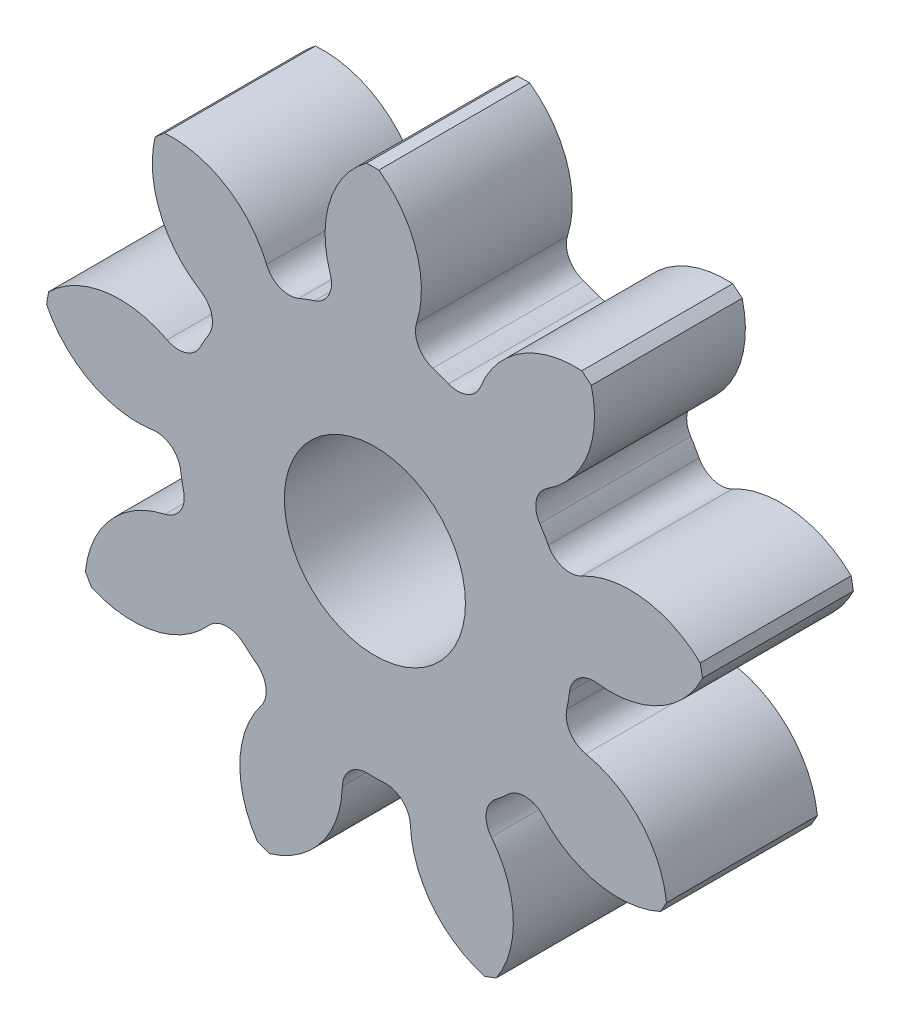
SolidWorks part; units mm, degrees
ref_plane "Front" through (0, 0, 0) normal (0, 0, 1) x (1, 0, 0)
ref_plane "Top" through (0, 0, 0) normal (0, 1, 0) x (1, 0, 0)
ref_plane "Right" through (0, 0, 0) normal (1, 0, 0) x (0, 0, -1)
sketch "Sketch3" plane through (0, 0, 0) normal (0, 0, 1) x (1, 0, 0)
  circle A0 centre (0, 0) radius 279.4
  dimension "od" = 558.8
extrude "gearBody" add sketch "Sketch3" along normal blind 127
sketch "Sketch2" plane through (0, 0, 0) normal (0, 0, 1) x (1, 0, 0)
  line L0 (0, 0) -> (198.462, 82.2057) construction
  line L1 (245.9361, -143.2533) -> (0, 0) construction
  line L2 (0, 0) -> (36.3143, 0) construction
  line L3 (228.5908, 2.0468) -> (215.1564, -77.2379) construction
  line L5 (221.8736, -37.5956) -> (0, 0) construction
  line L7 (0, 0) -> (214.8137, 0) construction
  arc A0 (214.8057, -1.8543) -> (203.4259, -69.0133) centre (0, 0) ccw construction
  arc A1 (275.7114, 45.2501) -> (245.4141, -133.5526) centre (0, 0) ccw construction
  arc A2 (228.5908, 2.0468) -> (215.1564, -77.2379) centre (0, 0) ccw construction
  arc A3 (161.4484, -34.5316) -> (163.812, -20.5824) centre (0, 0) ccw
  arc A4 (245.9361, -143.2533) -> (177.5117, -59.1098) centre (160.3024, -142.9968) ccw
  arc A5 (245.9361, -143.2533) -> (279.4, 54.2373) centre (0, 0) ccw
  arc A6 (279.4, 54.2373) -> (187.0755, -2.668) centre (198.462, 82.2057) cw
  arc A7 (163.812, -20.5824) -> (187.0755, -2.668) centre (184.3263, -23.16) cw
  arc A8 (177.5117, -59.1098) -> (161.4484, -34.5316) centre (181.6667, -38.856) cw
  point P6 (279.4, 54.2373)
  point P22 (245.9361, -143.2533)
  dimension "baseDia" = 429.6275
  dimension "od" = 558.8
  dimension "pd" = 457.2
  dimension "rd" = 330.2
  dimension "rFillet" = 20.6756
  dimension "pointX" = 279.4
  dimension "pointY" = 54.2373
  dimension "CTT" = 79.2847
  dimension "flankCenterAngle" = 22.5
extrude "toothCut" cut sketch "Sketch2" along normal through all
pattern_circular "CirPattern1" count 9 over 360 about axis through (0, 0, 0) along (0, 0, 1) of "toothCut"
sketch "hub1Dia" plane through (0, 0, 0) normal (0, 0, -1) x (-1, 0, 0)
  circle A0 centre (0, 0) radius 12.7
  dimension "hub1Dia" = 25.4
sketch "hub2Dia" plane through (0, 0, 127) normal (0, 0, 1) x (1, 0, 0)
  circle A0 centre (0, 0) radius 12.7
  dimension "hub2dia" = 25.4
sketch "boreDia" plane through (0, 0, 0) normal (0, 0, 1) x (1, 0, 0)
  circle A0 centre (0, 0) radius 76.2
  dimension "boreDia" = 152.4
extrude "bore" cut sketch "boreDia" against normal mid plane 25400
